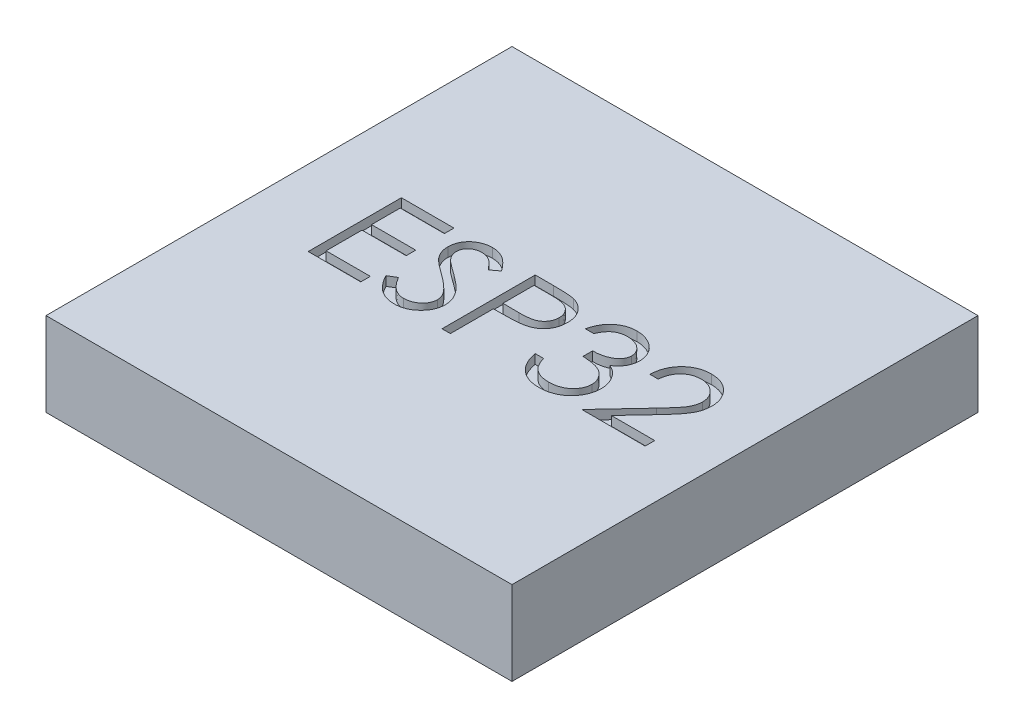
SolidWorks part; units mm, degrees
ref_plane "Front Plane" through (0, 0, 0) normal (0, 0, 1) x (1, 0, 0)
ref_plane "Top Plane" through (0, 0, 0) normal (0, 1, 0) x (1, 0, 0)
ref_plane "Right Plane" through (0, 0, 0) normal (1, 0, 0) x (0, 0, -1)
sketch "Sketch1" plane through (0, 0, 0) normal (0, 1, 0) x (1, 0, 0)
  line L1 (-2.5, 2.5) -> (2.5, 2.5)
  line L2 (-2.5, 2.5) -> (-2.5, -2.5)
  line L3 (-2.5, -2.5) -> (2.5, -2.5)
  line L4 (2.5, 2.5) -> (2.5, -2.5)
  line L5 (-2.5, 2.5) -> (2.5, -2.5) construction
  line L6 (-2.5, -2.5) -> (2.5, 2.5) construction
  point P0 (0, 0)
  dimension "D1" = 5
  dimension "D2" = 5
extrude "Boss-Extrude1" add sketch "Sketch1" along normal blind 0.9
sketch "Sketch2" plane through (0, 0.9, 0) normal (0, 1, 0) x (1, 0, 0)
  text T0 "ESP32" font "Century Gothic" height 1
extrude "Cut-Extrude1" cut sketch "Sketch2" against normal blind 0.1
